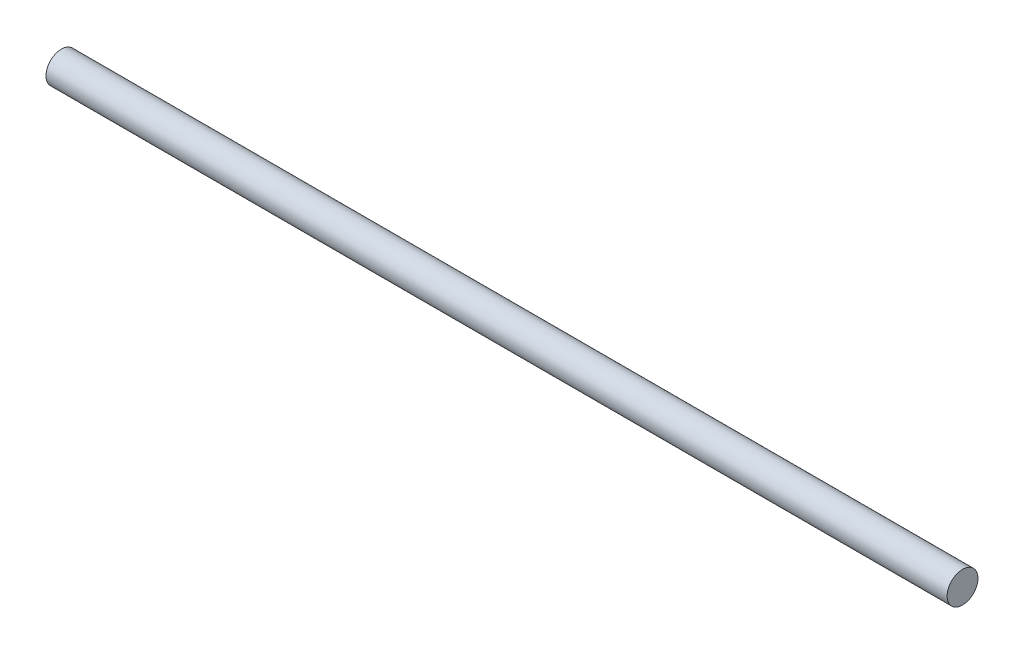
SolidWorks part; units mm, degrees
ref_plane "Front Plane" through (0, 0, 0) normal (0, 0, 1) x (1, 0, 0)
ref_plane "Top Plane" through (0, 0, 0) normal (0, 1, 0) x (1, 0, 0)
ref_plane "Right Plane" through (0, 0, 0) normal (1, 0, 0) x (0, 0, -1)
sketch "Sketch1" plane through (0, 0, 0) normal (1, 0, 0) x (0, 0, -1)
  circle A0 centre (0, 0) radius 3
  dimension "D1" = 6
extrude "Boss-Extrude1" add sketch "Sketch1" along normal blind 175
